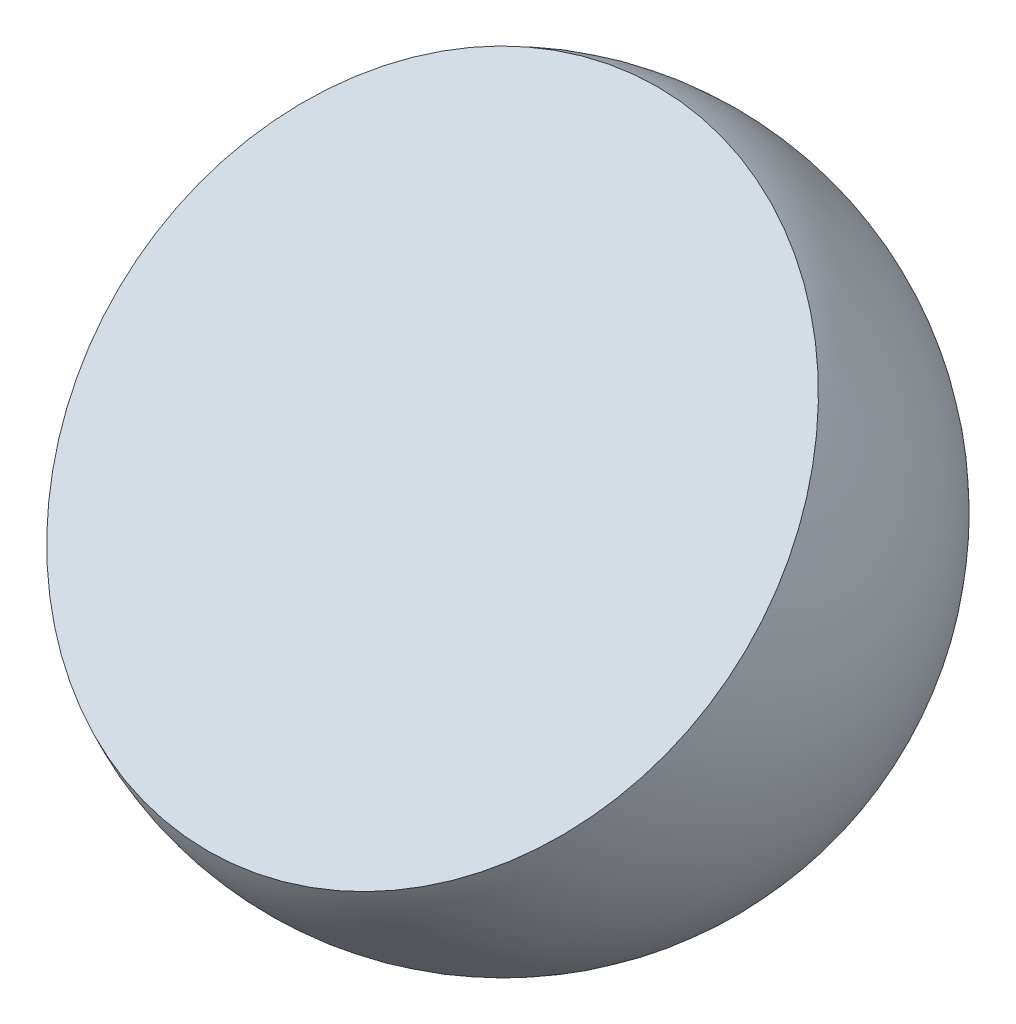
SolidWorks part; units mm, degrees
ref_plane "前视基准面" through (0, 0, 0) normal (0, 0, 1) x (1, 0, 0)
ref_plane "上视基准面" through (0, 0, 0) normal (0, 1, 0) x (1, 0, 0)
ref_plane "右视基准面" through (0, 0, 0) normal (1, 0, 0) x (0, 0, -1)
sketch "草图1" plane through (0, 0, 0) normal (1, 0, 0) x (0, 0, -1)
  line L0 (0, 47.1802) -> (0, -42.3996) construction
  line L1 (0, 30) -> (0, -30)
  arc A0 (0, -30) -> (0, 30) centre (0, 0) ccw
  dimension "D1" = 60
revolve "旋转3" add sketch "草图1" angle 360 about L0
sketch "草图2" plane through (0, 0, 0) normal (1, 0, 0) x (0, 0, -1)
  line L0 (21.6497, 33.9012) -> (-32.4556, -18.6626)
  line L1 (-32.4556, -18.6626) -> (-40.4712, 35.9051)
  line L2 (-40.4712, 35.9051) -> (21.6497, 33.9012)
extrude "切除-拉伸1" cut sketch "草图2" against normal through all both and the other way through all
